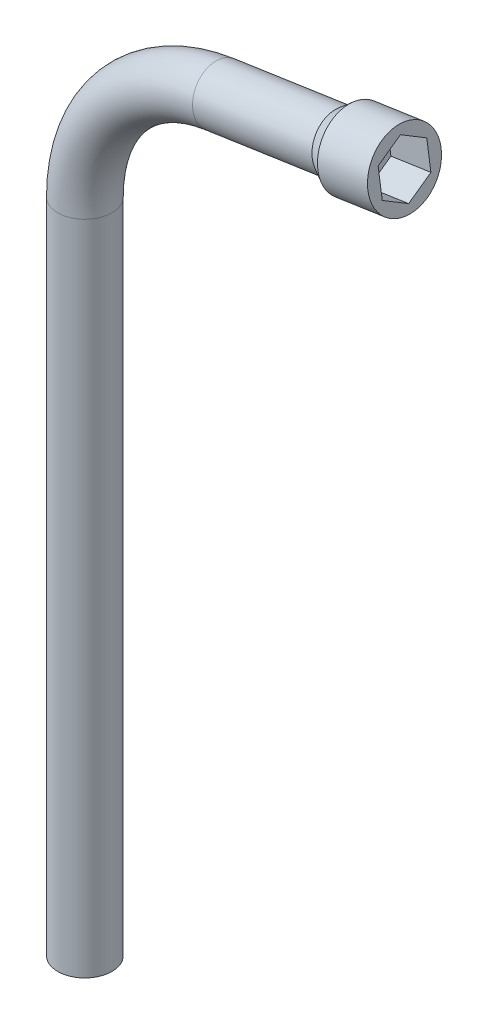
SolidWorks part; units mm, degrees
ref_plane "Front" through (0, 0, 0) normal (0, 0, 1) x (1, 0, 0)
ref_plane "Top" through (0, 0, 0) normal (0, 1, 0) x (1, 0, 0)
ref_plane "Right" through (0, 0, 0) normal (1, 0, 0) x (0, 0, -1)
sketch "Sketch1" plane through (0, 0, 0) normal (0, 0, 1) x (1, 0, 0)
  line L0 (0, 0) -> (0, 230.598)
  line L1 (47.403, 285.5687) -> (89.3258, 291.8007)
  arc A0 (0, 230.598) -> (47.403, 285.5687) centre (55.5747, 230.598) cw
ref_plane "Plane4" through (89.3258, 291.8007, 0) normal (0.9891, 0.147, 0) x (0, 0, -1)
sketch "Sketch8" plane through (89.3258, 291.8007, 0) normal (0.9891, 0.147, 0) x (0, 0, -1)
  circle A0 centre (0, 0) radius 9.525
sweep "Sweep2" add profiles "Sketch8" path "Sketch1"
sketch "Sketch6" plane through (0, 0, 0) normal (0, 0, 1) x (1, 0, 0)
  line L0 (87.9252, 301.2222) -> (89.3258, 291.8007)
  line L2 (87.9252, 301.2222) -> (92.7358, 305.3018)
  line L3 (92.7358, 305.3018) -> (110.2933, 307.9118)
  line L4 (110.2933, 307.9118) -> (112.1832, 295.1986)
  line L5 (112.1832, 295.1986) -> (89.3258, 291.8007)
  line L7 (89.3258, 291.8007) -> (125.4868, 297.1763) construction
  line L8 (92.5976, 269.7913) -> (86.0539, 313.8102) construction
  line L9 (87.9252, 301.2222) -> (46.0025, 294.9902) construction
  dimension "D1" = 9.525
revolve "Revolve2" add sketch "Sketch6" angle 360 about L7
sketch "Sketch9" plane through (152.6917, 22.6984, 0) normal (0.9891, 0.147, 0) x (0, 0, -1)
  line L1 (0, 285.3505) -> (-8.5355, 280.4226)
  line L2 (-8.5355, 280.4226) -> (-8.5355, 270.5666)
  line L3 (-8.5355, 270.5666) -> (0, 265.6387)
  line L4 (0, 265.6387) -> (8.5355, 270.5666)
  line L5 (8.5355, 270.5666) -> (8.5355, 280.4226)
  line L6 (8.5355, 280.4226) -> (0, 285.3505)
  circle A0 centre (0, 275.4946) radius 8.5355 construction
extrude "Cut-Extrude3" cut sketch "Sketch9" against normal blind 14.1869
